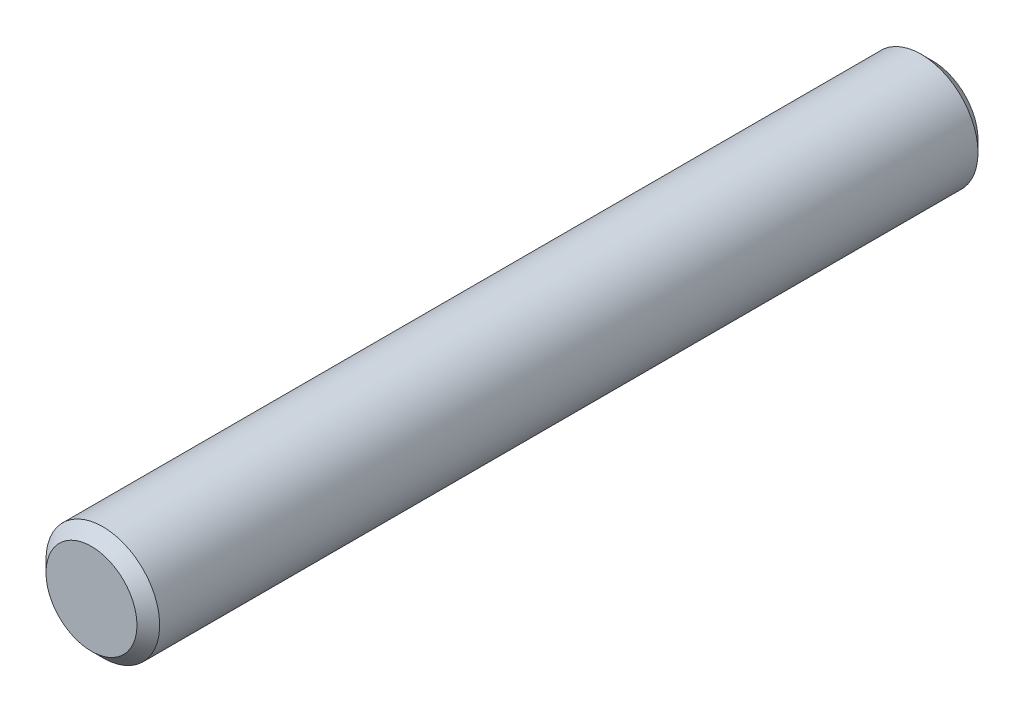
SolidWorks part; units mm, degrees
ref_plane "XZ (Face)" through (0, 0, 0) normal (0, 0, 1) x (1, 0, 0)
ref_plane "XY (Dessus)" through (0, 0, 0) normal (0, 1, 0) x (1, 0, 0)
ref_plane "YZ (Droite)" through (0, 0, 0) normal (1, 0, 0) x (0, 0, -1)
sketch "Esquisse1" plane through (0, 0, 0) normal (0, 0, 1) x (1, 0, 0)
  circle A0 centre (21.3892, -12.75) radius 1.25 construction
  circle A1 centre (21.3892, -12.75) radius 1.25
extrude "Base-Extrusion" add sketch "Esquisse1" along normal up to surface (18.5 mm away)
chamfer "Chanfrein1" distance 0.25 angle 45
